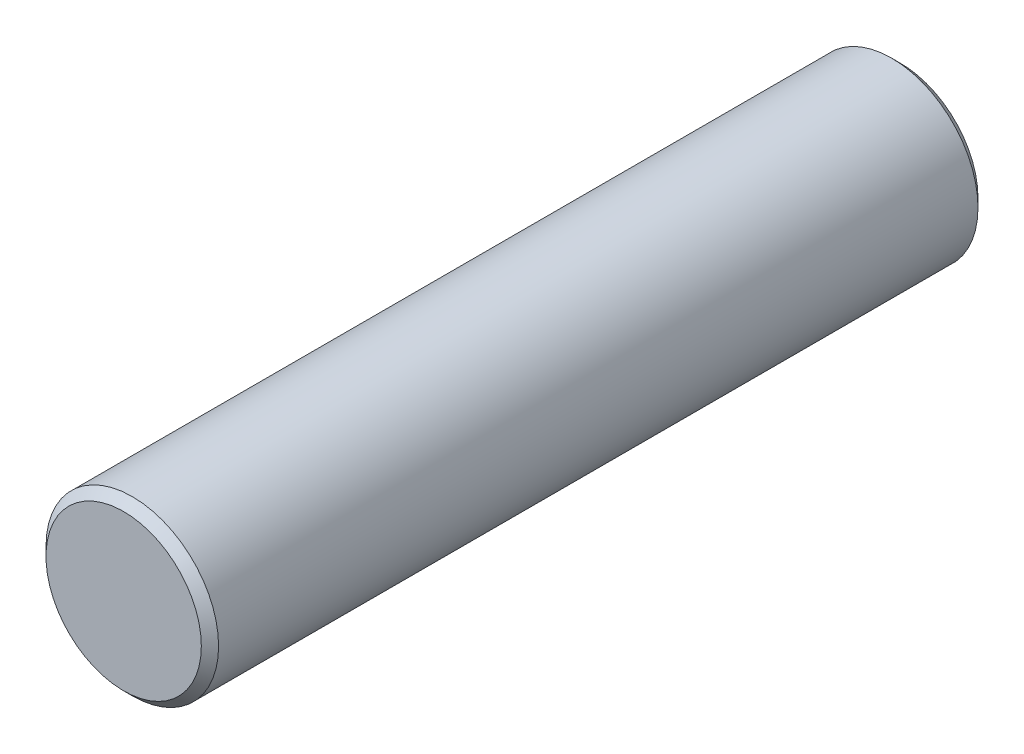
SolidWorks part; units mm, degrees
ref_plane "Plan de face" through (0, 0, 0) normal (0, 0, 1) x (1, 0, 0)
ref_plane "Plan de dessus" through (0, 0, 0) normal (0, 1, 0) x (1, 0, 0)
ref_plane "Plan de droite" through (0, 0, 0) normal (1, 0, 0) x (0, 0, -1)
sketch "Esquisse1" plane through (0, 0, 0) normal (0, 0, 1) x (1, 0, 0)
  circle A0 centre (0, 0) radius 2
  dimension "D1" = 4
extrude "Base cylindrique" add sketch "Esquisse1" along normal blind 18
chamfer "Chanfreins" distance 0.2 angle 45 2 edges at (2, 0, 18) (2, 0, 0)
